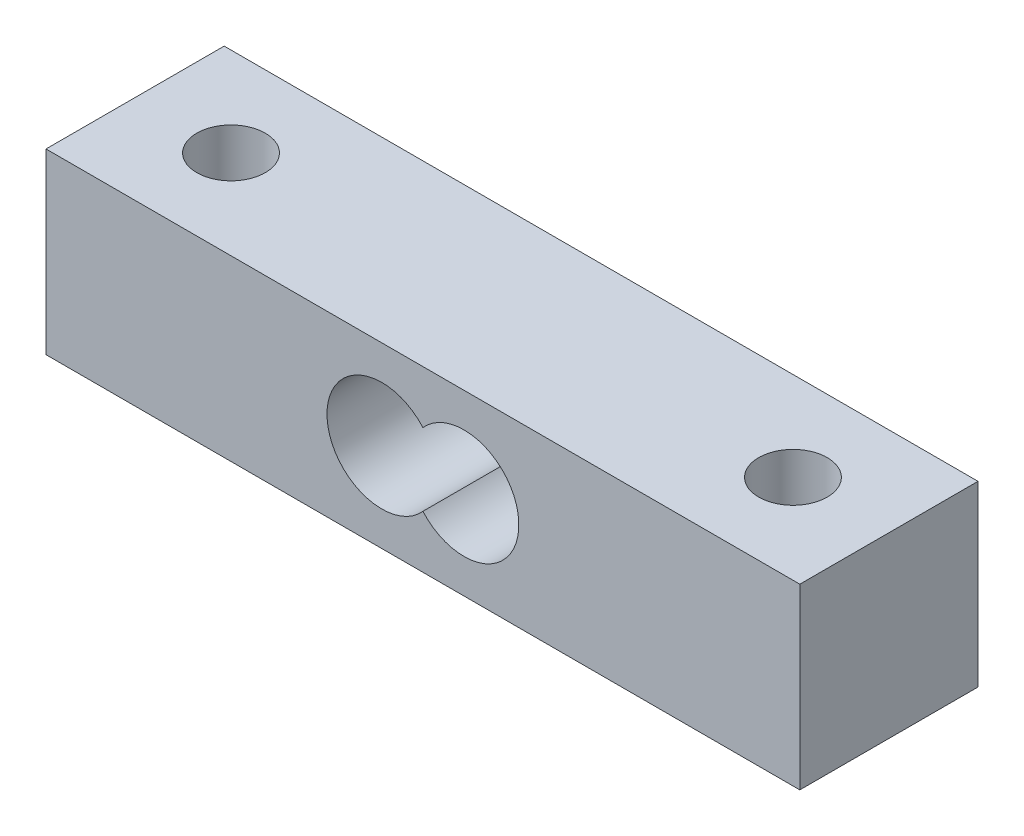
SolidWorks part; units mm, degrees
ref_plane "Plan de face" through (0, 0, 0) normal (0, 0, 1) x (1, 0, 0)
ref_plane "Plan de dessus" through (0, 0, 0) normal (0, 1, 0) x (1, 0, 0)
ref_plane "Plan de droite" through (0, 0, 0) normal (1, 0, 0) x (0, 0, -1)
sketch "Esquisse1" plane through (0, 0, 0) normal (0, 0, 1) x (1, 0, 0)
  line L1 (-27.5, 6.5) -> (27.5, 6.5)
  line L2 (-27.5, 6.5) -> (-27.5, -6.5)
  line L3 (-27.5, -6.5) -> (27.5, -6.5)
  line L4 (27.5, 6.5) -> (27.5, -6.5)
  arc A0 (0, 2.6458) -> (0, -2.6458) centre (-3, 0) ccw
  arc A1 (0, -2.6458) -> (0, 2.6458) centre (3, 0) ccw
  dimension "D5" = 8
  dimension "D6" = 8
  dimension "D1" = 55
  dimension "D2" = 13
  dimension "D3" = 6.5
  dimension "D4" = 27.5
  dimension "D7" = 3
  dimension "D8" = 3
extrude "Boss.-Extru.1" add sketch "Esquisse1" along normal blind 13
sketch "Esquisse2" plane through (0, 6.5, 0) normal (0, 1, 0) x (1, 0, 0)
  line L0 (-27.5, -13) -> (-27.5, 0) construction
  line L1 (27.5, -13) -> (27.5, 0) construction
  circle A0 centre (-20.5, -6.5) radius 2.5
  circle A1 centre (20.5, -6.5) radius 2.5
  dimension "D1" = 5
  dimension "D4" = 5
  dimension "D2" = 7
  dimension "D3" = 7
extrude "Enlèv. mat.-Extru.1" cut sketch "Esquisse2" against normal blind 13
